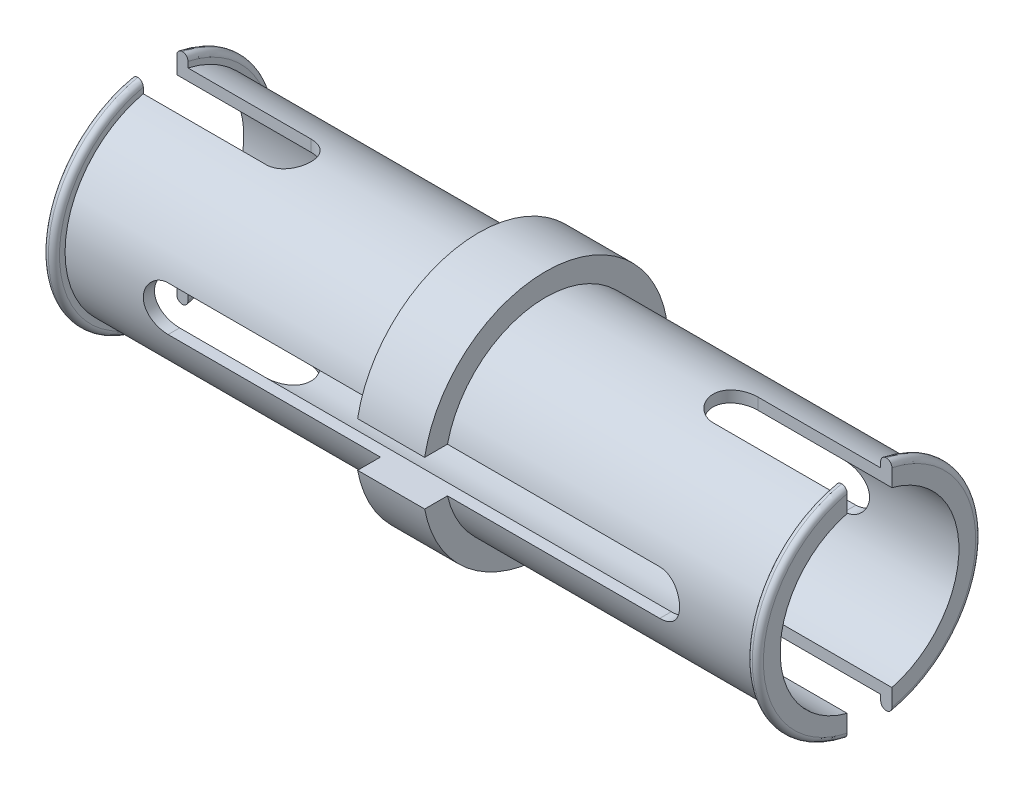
SolidWorks part; units mm, degrees
ref_plane "Face" through (0, 0, 0) normal (0, 0, 1) x (1, 0, 0)
ref_plane "Dessus" through (0, 0, 0) normal (0, 1, 0) x (1, 0, 0)
ref_plane "Droite" through (0, 0, 0) normal (1, 0, 0) x (0, 0, -1)
sketch "Esquisse1" plane through (0, 0, 0) normal (0, 1, 0) x (1, 0, 0)
  line L0 (0, 0) -> (0.25, 0)
  line L1 (0, 0) -> (0, -2.5)
  line L2 (0.25, 0) -> (0.25, -0.25)
  line L3 (0.25, -0.25) -> (7.25, -0.25)
  line L4 (7.25, -0.25) -> (7.25, 0.25)
  line L5 (7.25, 0.25) -> (8.75, 0.25)
  line L6 (8.75, 0.25) -> (8.75, -0.25)
  line L7 (8.75, -0.25) -> (15.75, -0.25)
  line L8 (15.75, -0.25) -> (15.75, 0)
  line L9 (15.75, 0) -> (16, 0)
  line L10 (16, 0) -> (16, -2.5)
  line L11 (-0.6463, -2.5) -> (11.6355, -2.5) construction
  line L12 (0, -2.5) -> (16, -2.5)
  dimension "D1" = 7
  dimension "D2" = 16
  dimension "D3" = 7
  dimension "D4" = 1.5
revolve "Base-Révolution" add sketch "Esquisse1" angle 360 about L11
sketch "Esquisse2" plane through (16, 0, 0) normal (1, 0, 0) x (0, 0, -1)
  line L0 (1.0465, 0) -> (-6.0165, 0) construction
  line L1 (-5, -1.0979) -> (-5, 2.0995) construction
  circle A0 centre (-2.5, 0) radius 2
  circle A3 centre (-2.5, 0) radius 2.5 construction
  dimension "D2" = 4
  dimension "D1" = 5
extrude "Enlèv. mat.-Extru.1" cut sketch "Esquisse2" against normal through all
fillet "Congé2" radius 0.125 4 edges at (15.75, 0, 5) (16, 0, 5) (0, 0, 5) (0.25, 0, 5)
sketch "Esquisse3" plane through (0, 0, 0) normal (0, 0, 1) x (1, 0, 0)
  line L0 (0, 0) -> (16, 0) construction
  line L1 (16, -2.375) -> (16, 2.375) construction
  line L2 (13.5, 0.5) -> (2.5, 0.5)
  line L3 (-0.2307, 0) -> (11.3465, 0) construction
  line L4 (13.5, -0.5) -> (2.5, -0.5)
  arc A0 (2.5, 0.5) -> (2.5, -0.5) centre (2.5, 0) ccw
  arc A1 (13.5, -0.5) -> (13.5, 0.5) centre (13.5, 0) ccw
  dimension "D1" = 2.5
extrude "Enlèv. mat.-Extru.2" cut sketch "Esquisse3" against normal mid plane 11.1379
sketch "Esquisse4" plane through (0, 0, 0) normal (0, 1, 0) x (1, 0, 0)
  line L1 (3, -2) -> (0, -2)
  line L2 (16, -2) -> (16, -3)
  line L3 (3, -3) -> (0, -3)
  line L5 (11.4126, -2.5) -> (-0.5119, -2.5) construction
  line L6 (0, -2.5) -> (16, -2.5) construction
  line L7 (0, -2) -> (0, -3)
  line L8 (16, -2) -> (13, -2)
  line L9 (16, -3) -> (13, -3)
  arc A0 (13, -2) -> (13, -3) centre (13, -2.5) ccw
  arc A1 (3, -3) -> (3, -2) centre (3, -2.5) ccw
extrude "Enlèv. mat.-Extru.3" cut sketch "Esquisse4" against normal mid plane 6
